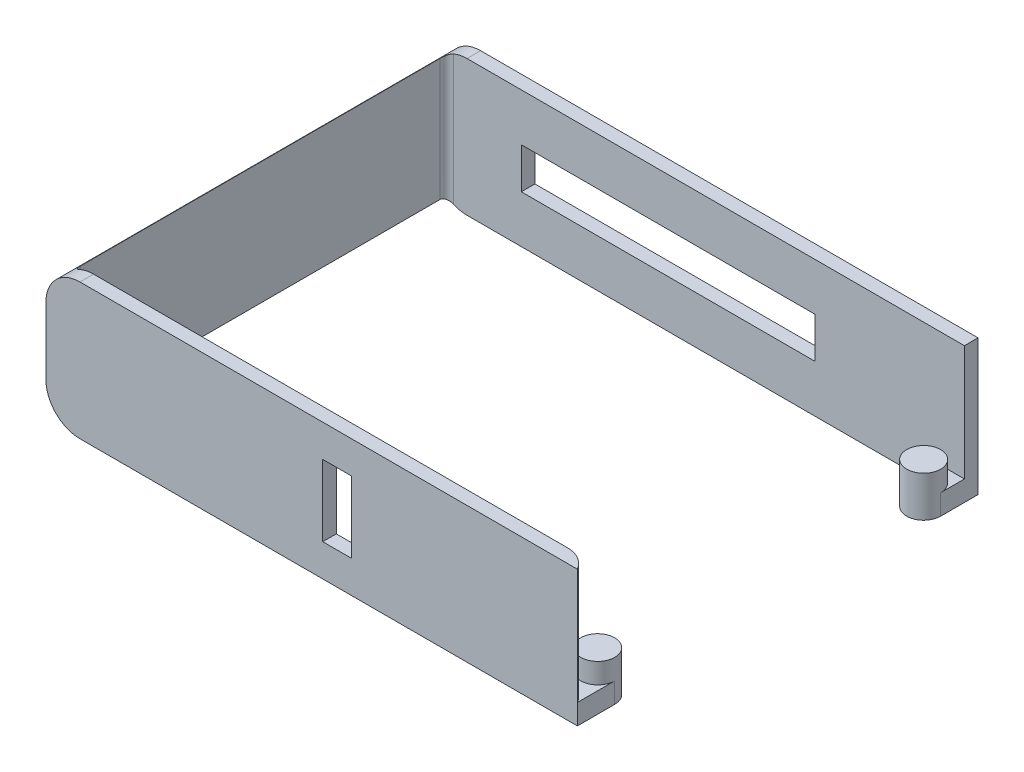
SolidWorks part; units mm, degrees
ref_plane "Front Plane" through (0, 0, 0) normal (0, 0, 1) x (1, 0, 0)
ref_plane "Top Plane" through (0, 0, 0) normal (0, 1, 0) x (1, 0, 0)
ref_plane "Right Plane" through (0, 0, 0) normal (1, 0, 0) x (0, 0, -1)
sketch "Sketch1" plane through (0, 0, 0) normal (0, 0, 1) x (1, 0, 0)
  line L1 (-39.125, 20) -> (39.125, 20)
  line L2 (-39.125, 20) -> (-39.125, 0)
  line L3 (-39.125, 0) -> (39.125, 0)
  line L4 (39.125, 20) -> (39.125, 0)
  dimension "D1" = 20
  dimension "D2" = 78.25
extrude "Extrude1" add sketch "Sketch1" along normal blind 2
sketch "Sketch2" plane through (0, 0, 0) normal (0, 1, 0) x (1, 0, 0)
  line L0 (34.125, -2) -> (34.125, -5.5)
  line L1 (39.125, -2) -> (-39.125, -2) construction
  line L2 (39.125, -2) -> (39.125, -5.5)
  line L3 (34.125, -2) -> (39.125, -2)
  line L5 (39.125, -2) -> (39.125, 0) construction
  arc A0 (34.125, -5.5) -> (39.125, -5.5) centre (36.625, -5.5) ccw
  dimension "D1" = 2.5
  dimension "D2" = 3.5
extrude "Extrude2" add sketch "Sketch2" along normal blind 3
sketch "Sketch4" plane through (0, 0, 2) normal (0, 0, 1) x (1, 0, 0)
  line L0 (-39.125, 0) -> (34.125, 0) construction
  line L1 (-39.125, 20) -> (-37.125, 20)
  line L2 (-39.125, 20) -> (-39.125, 0)
  line L3 (-39.125, 0) -> (-37.125, 0)
  line L4 (-37.125, 20) -> (-37.125, 0)
  dimension "D1" = 2
extrude "Extrude3" add sketch "Sketch4" along normal blind 27.5
sketch "Sketch7" plane through (0, 3, 0) normal (0, 1, 0) x (-1, 0, 0)
  circle A0 centre (-36.625, 5.5) radius 2.5
  arc A1 (-34.125, 5.5) -> (-39.125, 5.5) centre (-36.625, 5.5) ccw construction
extrude "Extrude4" add sketch "Sketch7" along normal blind 3
mirror "Mirror2" about plane through (-39.125, 0, 29.5) normal (0, 0, 1) of "Extrude3", "Extrude1"
sketch "Sketch8" plane through (0, 0, 57) normal (0, 0, 1) x (1, 0, 0)
  line L1 (-39.125, 0) -> (39.125, 0)
  line L2 (-39.125, 0) -> (-39.125, 20)
  line L3 (-39.125, 20) -> (39.125, 20)
  line L4 (39.125, 0) -> (39.125, 20)
extrude "Extrude5" add sketch "Sketch8" along normal blind 2
ref_plane "Plane1" through (0, 0, 29.5) normal (0, 0, 1) x (1, 0, 0)
mirror "Mirror3" about plane through (0, 0, 29.5) normal (0, 0, 1) of "Extrude4", "Extrude2"
fillet "Fillet1" radius 5 7 edges at (-39.125, 20, 29.5) (-39.125, 0, 29.5)
fillet "Fillet2" radius 1 2 edges at (-37.125, 10, 2)
sketch "Sketch14" plane through (0, 0, 0) normal (0, 0, -1) x (-1, 0, 0)
  line L0 (-39.125, 10) -> (39.125, 10) construction
  line L1 (-17.125, 13) -> (26.125, 13)
  line L2 (-17.125, 13) -> (-17.125, 7)
  line L3 (-17.125, 7) -> (26.125, 7)
  line L4 (26.125, 13) -> (26.125, 7)
  line L5 (-39.125, 0) -> (-39.125, 20) construction
  line L6 (39.125, 15) -> (39.125, 5) construction
  line L7 (36.125, 19.5826) -> (36.125, 0.4174) construction
  dimension "D1" = 6
  dimension "D2" = 22
  dimension "D3" = 10
extrude "Cut-Extrude1" cut sketch "Sketch14" against normal up to next
sketch "Sketch15" plane through (0, 0, 59) normal (0, 0, 1) x (1, 0, 0)
  line L0 (39.125, 0) -> (39.125, 20) construction
  line L1 (1.625, 15.25) -> (5.875, 15.25)
  line L2 (1.625, 15.25) -> (1.625, 4.75)
  line L3 (1.625, 4.75) -> (5.875, 4.75)
  line L4 (5.875, 15.25) -> (5.875, 4.75)
  line L5 (-34.125, 0) -> (39.125, 0) construction
  dimension "D1" = 33.25
  dimension "D2" = 4.25
  dimension "D3" = 10.5
  dimension "D4" = 4.75
extrude "Cut-Extrude2" cut sketch "Sketch15" against normal blind 10
fillet "Fillet3" radius 4 3 edges at (39.125, 20, 58) (39.125, 11.5, 57)
